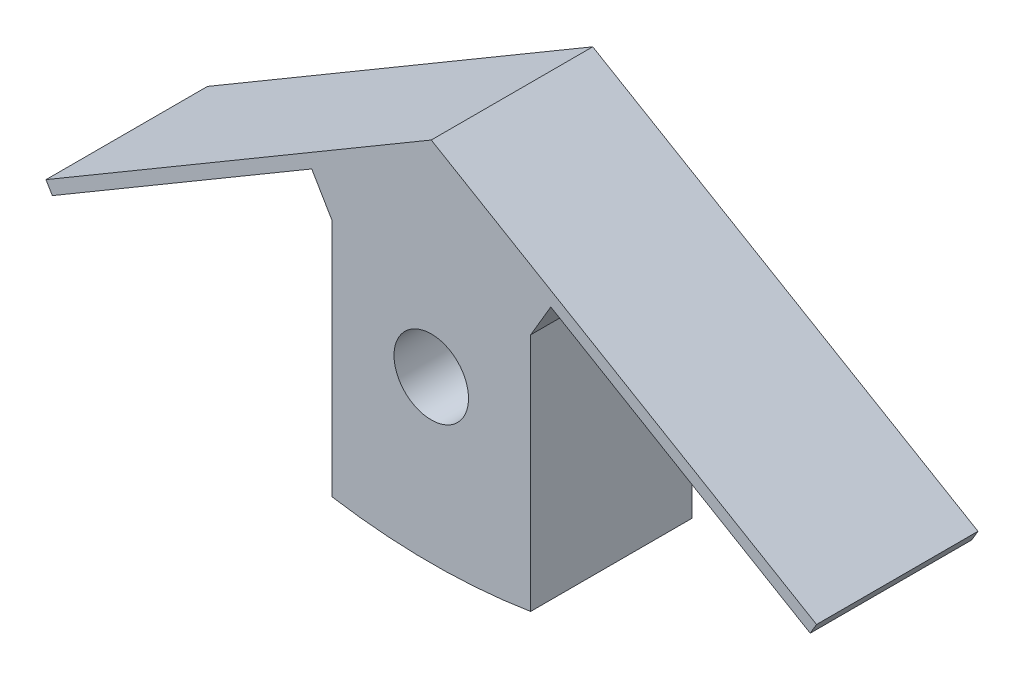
SolidWorks part; units mm, degrees
ref_plane "Plan de face" through (0, 0, 0) normal (0, 0, 1) x (1, 0, 0)
ref_plane "Plan de dessus" through (0, 0, 0) normal (0, 1, 0) x (1, 0, 0)
ref_plane "Plan de droite" through (0, 0, 0) normal (1, 0, 0) x (0, 0, -1)
sketch "Esquisse1" plane through (0, 0, 0) normal (0, 0, 1) x (1, 0, 0)
  line L0 (0, -51.5124) -> (0, 20) construction
  line L1 (8, -10.0673) -> (8, -29.3559)
  line L2 (-31.0186, -18.7543) -> (-30.5111, -19.6159)
  line L3 (0, -0.4829) -> (31.0186, -18.7543)
  line L4 (31.0186, -18.7543) -> (30.5111, -19.6159)
  line L5 (30.5111, -19.6159) -> (9.623, -7.3119)
  line L6 (9.623, -7.3119) -> (8, -10.0673)
  line L7 (-30.5111, -19.6159) -> (-9.623, -7.3119)
  line L8 (-9.623, -7.3119) -> (-8, -10.0673)
  line L9 (-8, -10.0673) -> (-8, -29.3559)
  line L10 (0, -0.4829) -> (-31.0186, -18.7543)
  arc A0 (-8, -29.3559) -> (8, -29.3559) centre (0, 20) ccw
  dimension "D1" = 100
  dimension "D2" = 8
  dimension "D3" = 20
  dimension "D6" = 36
  dimension "D8" = 1
extrude "Boss.-Extru.1" add sketch "Esquisse1" along normal blind 13
sketch "Esquisse2" plane through (0, 0, 0) normal (0, 0, 1) x (1, 0, 0)
  circle A0 centre (0, -26) radius 2
  circle A1 centre (0, 20) radius 50 construction
  dimension "D1" = 46
  dimension "D2" = 100
extrude "Boss.-Extru.2" add sketch "Esquisse2" against normal blind 13
sketch "Esquisse3" plane through (0, 0, 0) normal (0, 0, -1) x (-1, 0, 0)
  line L0 (-2, -26) -> (2, -26) construction
  circle A0 centre (0, -17) radius 3
  circle A1 centre (0, -26) radius 2 construction
  circle A2 centre (0, -26) radius 2 construction
  dimension "D1" = 9
extrude "Enlèv. mat.-Extru.2" cut sketch "Esquisse3" against normal through all and the other way through all
